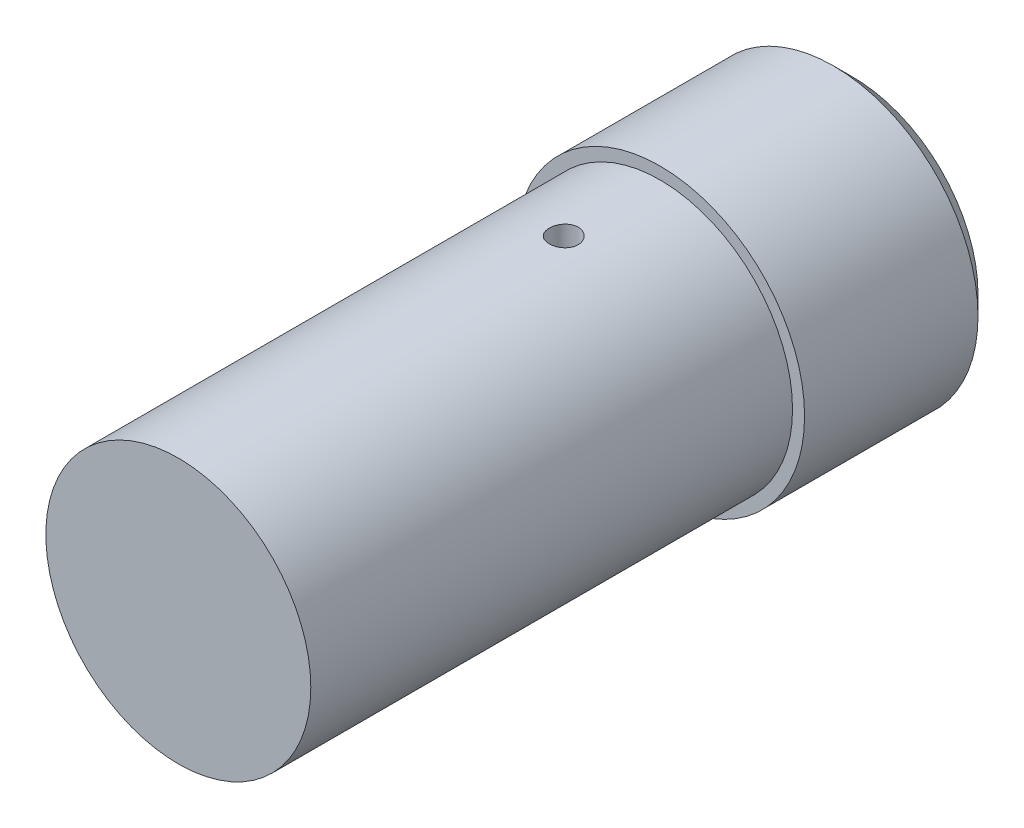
SolidWorks part; units mm, degrees
ref_plane "Plan1" through (0, 0, 0) normal (0, 0, 1) x (1, 0, 0)
ref_plane "Plan2" through (0, 0, 0) normal (0, 1, 0) x (1, 0, 0)
ref_plane "Plan3" through (0, 0, 0) normal (1, 0, 0) x (0, 0, -1)
sketch "Esquisse1" plane through (0, 0, 0) normal (0, 0, 1) x (1, 0, 0)
  circle A0 centre (0, 0) radius 30
extrude "Base-Extrusion" add sketch "Esquisse1" along normal blind 40
sketch "Esquisse2" plane through (0, 0, 40) normal (0, 0, 1) x (1, 0, 0)
  circle A0 centre (0, 0) radius 27.5
  dimension "D1" = 55
extrude "Boss.-Extru.1" add sketch "Esquisse2" along normal blind 100
ref_plane "Plan4" through (0, 30, 0) normal (0, 1, 0) x (-1, 0, 0)
sketch "Esquisse3" plane through (0, 30, 0) normal (0, 1, 0) x (-1, 0, 0)
  line L0 (0, 40) -> (0, 0) construction
  circle A0 centre (0, 60) radius 3
extrude "Enlèv. mat.-Extru.1" cut sketch "Esquisse3" against normal blind 30
chamfer "Chanfrein1" distance 4 angle 45 1 edges at (30, 0, 0)
ref_plane "Plan5" through (0, 0, 34) normal (0, 0, 1) x (1, 0, 0)
sketch "G2" plane through (0, 0, 34) normal (0, 0, 1) x (1, 0, 0)
  point P0 (0, 0)
